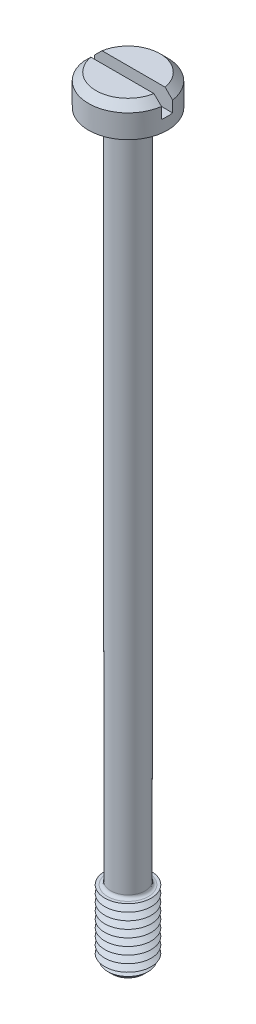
SolidWorks part; units mm, degrees
ref_plane "Front Plane" through (0, 0, 0) normal (0, 0, 1) x (1, 0, 0)
ref_plane "Top Plane" through (0, 0, 0) normal (0, 1, 0) x (1, 0, 0)
ref_plane "Right Plane" through (0, 0, 0) normal (1, 0, 0) x (0, 0, -1)
sketch "Sketch1" plane through (0, 0, 0) normal (0, 1, 0) x (1, 0, 0)
  circle A0 centre (0, 0) radius 4.25
  dimension "D1" = 8.5
extrude "Boss-Extrude1" add sketch "Sketch1" along normal blind 3.3
sketch "Sketch2" plane through (0, 0, 0) normal (0, -1, 0) x (1, 0, 0)
  circle A0 centre (0, 0) radius 1.85
  dimension "D1" = 3.7
extrude "Boss-Extrude2" add sketch "Sketch2" along normal blind 80
sketch "Sketch3" plane through (0, -80, 0) normal (0, -1, 0) x (1, 0, 0)
  circle A0 centre (0, 0) radius 2.5
  dimension "D1" = 5
extrude "Boss-Extrude3" add sketch "Sketch3" against normal blind 7.5
chamfer "Chamfer1" distance 0.8 angle 45 1 edges at (0, -80, -2.5)
sketch "Sketch4" plane through (0, 0, 0) normal (1, 0, 0) x (0, 0, -1)
  line L0 (0, -6.5871) -> (0, -12.0372) construction
sketch "Sketch5" plane through (0, 0, 0) normal (1, 0, 0) x (0, 0, -1)
  line L0 (-2.5, -72.5) -> (-1.8072, -72.9)
  line L1 (-1.8072, -72.9) -> (-2.5, -73.3)
  line L2 (-2.5, -72.5) -> (-2.5, -79.2) construction
  line L3 (-2.5, -73.3) -> (-2.5, -72.5)
  dimension "D1" = 0.8
revolve "Cut-Revolve1" cut sketch "Sketch5" angle 360 about L0
pattern_linear "LPattern1" count 9 spacing 0.8 along (0, -1, 0) of "Cut-Revolve1"
fillet "Fillet1" radius 0.35 2 edges at (0, -72.5, -1.85) (0, 0, -1.85)
chamfer "Chamfer2" distance 0.8 angle 45 1 edges at (0, 3.3, 4.25)
sketch "Sketch6" plane through (0, 3.3, 0) normal (0, 1, 0) x (1, 0, 0)
  line L1 (4.25, -0.6) -> (-4.25, -0.6)
  line L2 (4.25, -0.6) -> (4.25, 0.6)
  line L3 (4.25, 0.6) -> (-4.25, 0.6)
  line L4 (-4.25, -0.6) -> (-4.25, 0.6)
  line L5 (4.25, -0.6) -> (-4.25, 0.6) construction
  line L6 (4.25, 0.6) -> (-4.25, -0.6) construction
  circle A0 centre (0, 0) radius 4.25 construction
  point P0 (0, 0)
  dimension "D1" = 1.2
extrude "Cut-Extrude1" cut sketch "Sketch6" against normal blind 2
